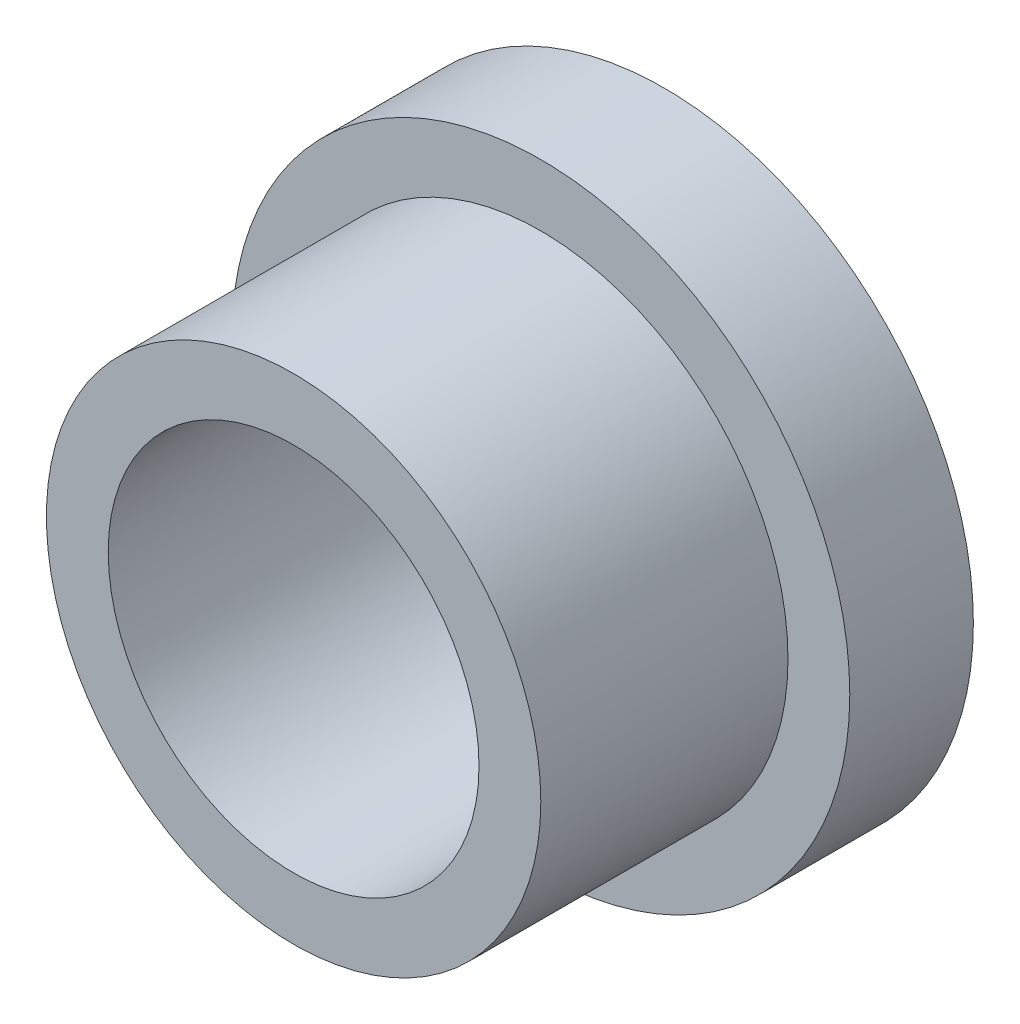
SolidWorks part; units mm, degrees
ref_plane "Face" through (0, 0, 0) normal (0, 0, 1) x (1, 0, 0)
ref_plane "Dessus" through (0, 0, 0) normal (0, 1, 0) x (1, 0, 0)
ref_plane "Droite" through (0, 0, 0) normal (1, 0, 0) x (0, 0, -1)
sketch "Esquisse1" plane through (0, 0, 0) normal (0, 0, 1) x (1, 0, 0)
  circle A0 centre (0, 0) radius 5
  circle A1 centre (0, 0) radius 3
  dimension "D1" = 10
  dimension "D2" = 6
extrude "Extrusion1" add sketch "Esquisse1" along normal blind 6
sketch "Esquisse2" plane through (0, 0, 6) normal (0, 0, 1) x (1, 0, 0)
  circle A0 centre (0, 0) radius 4
  circle A1 centre (0, 0) radius 5 construction
  dimension "D1" = 8
extrude "Enlèv. mat.-Extru.1" cut sketch "Esquisse2" against normal blind 4 flip side to cut
